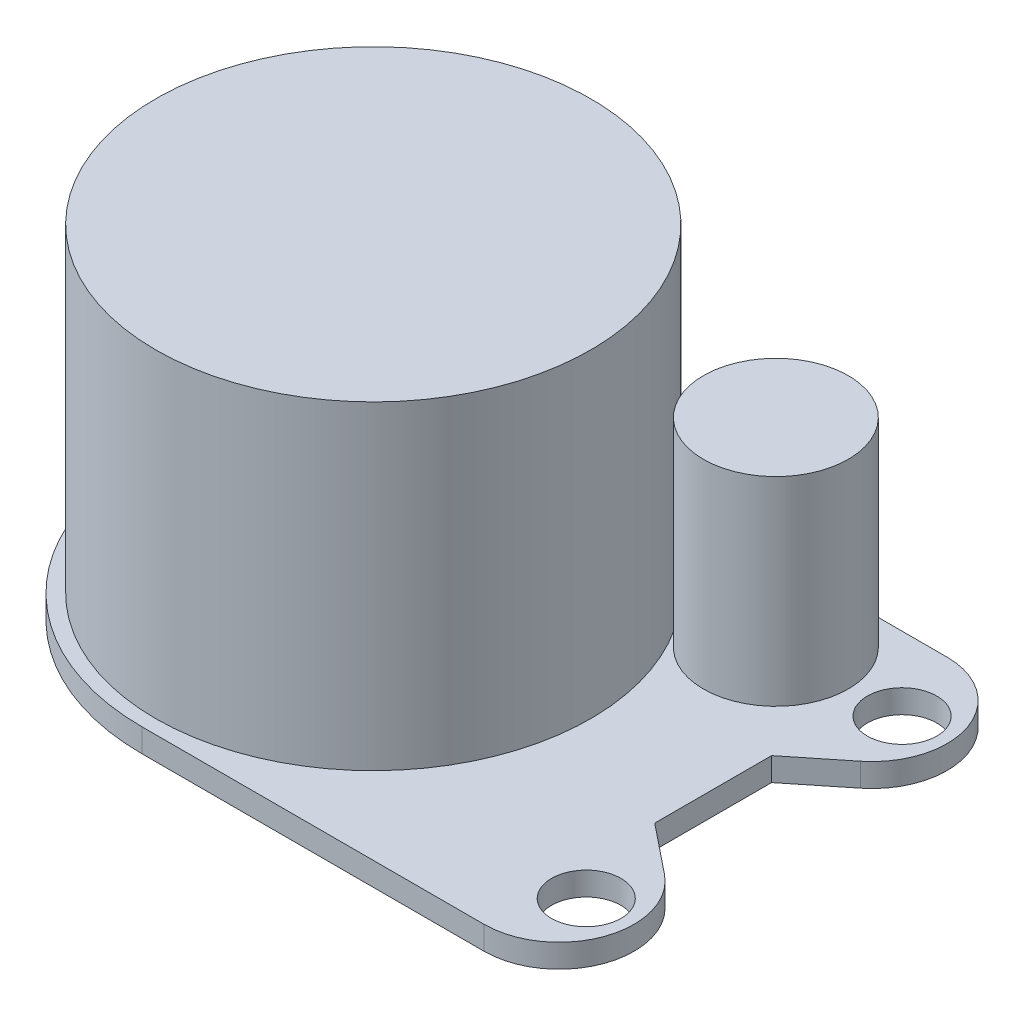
SolidWorks part; units mm, degrees
other "Markup1"
sketch "Sketch5" plane through (-38.4771, 14.66, 6.2903) normal (0, 1, 0) x (-1, 0, 0)
ref_plane "Front Plane" through (0, 0, 0) normal (0, 0, 1) x (1, 0, 0)
ref_plane "Top Plane" through (0, 0, 0) normal (0, 1, 0) x (1, 0, 0)
ref_plane "Right Plane" through (0, 0, 0) normal (1, 0, 0) x (0, 0, -1)
sketch "Sketch1" plane through (0, 0, 0) normal (0, 1, 0) x (1, 0, 0)
  line L0 (-13.933, -3.0843) -> (-13.933, 10.3038) construction
  line L1 (-13.933, 13.5097) -> (-28.5771, 13.5097)
  line L2 (-14.0371, 1.1097) -> (-11.9265, -0.5839)
  line L3 (-28.5771, -6.2903) -> (-13.933, -6.2903)
  line L4 (-13.933, 3.6097) -> (-28.5771, 3.6097) construction
  line L5 (-14.0371, 6.1097) -> (-14.0371, 1.1097)
  line L6 (-14.0371, 6.1097) -> (-11.9265, 7.8034)
  line L7 (-38.4771, 3.6097) -> (-38.4771, 28.7573) construction
  line L8 (-10.7271, 10.3038) -> (-10.7271, 30.8829) construction
  arc A0 (-11.9265, 7.8034) -> (-13.933, 13.5097) centre (-13.933, 10.3038) ccw
  arc A1 (-13.933, -6.2903) -> (-11.9265, -0.5839) centre (-13.933, -3.0843) ccw
  arc A2 (-28.5771, 13.5097) -> (-28.5771, -6.2903) centre (-28.5771, 3.6097) ccw
  point P13 (-14.0371, 3.6097)
  dimension "D1" = 9.9
  dimension "D2" = 27.75
  dimension "D3" = 24.44
  dimension "D4" = 19.8
  dimension "D5" = 5
extrude "Boss-Extrude1" add sketch "Sketch1" along normal blind 1
sketch "Sketch2" plane through (0, 1, 0) normal (0, 1, 0) x (1, 0, 0)
  circle A0 centre (-28.5771, 3.6097) radius 9.305
  dimension "D1" = 18.61
extrude "Boss-Extrude2" add sketch "Sketch2" along normal blind 13.66
sketch "Sketch3" plane through (0, 1, 0) normal (0, 1, 0) x (1, 0, 0)
  line L0 (-13.933, 13.5097) -> (-28.5771, 13.5097) construction
  circle A0 centre (-17.9627, 10.2157) radius 3.1
  dimension "D1" = 6.2
  dimension "D2" = 3.294
extrude "Boss-Extrude3" add sketch "Sketch3" along normal blind 8.51
sketch "Sketch4" plane through (0, 1, 0) normal (0, 1, 0) x (1, 0, 0)
  line L0 (-12.7121, 10.3647) -> (-12.7121, -3.1453) construction
  line L1 (-12.7121, 3.6097) -> (-14.0371, 3.6097) construction
  line L2 (-11.2271, -3.1453) -> (-11.2271, 2.4395) construction
  line L3 (-10.7271, -3.0843) -> (-10.7271, 2.4395) construction
  line L4 (-14.0371, 1.1097) -> (-14.0371, 6.1097) construction
  circle A0 centre (-12.7121, 10.3647) radius 1.485
  circle A1 centre (-12.7121, -3.1453) radius 1.485
  arc A2 (-13.933, -6.2903) -> (-11.9265, -0.5839) centre (-13.933, -3.0843) ccw construction
  dimension "D1" = 2.97
  dimension "D2" = 0.5
  dimension "D3" = 13.51
extrude "Cut-Extrude1" cut sketch "Sketch4" against normal blind 8.51
